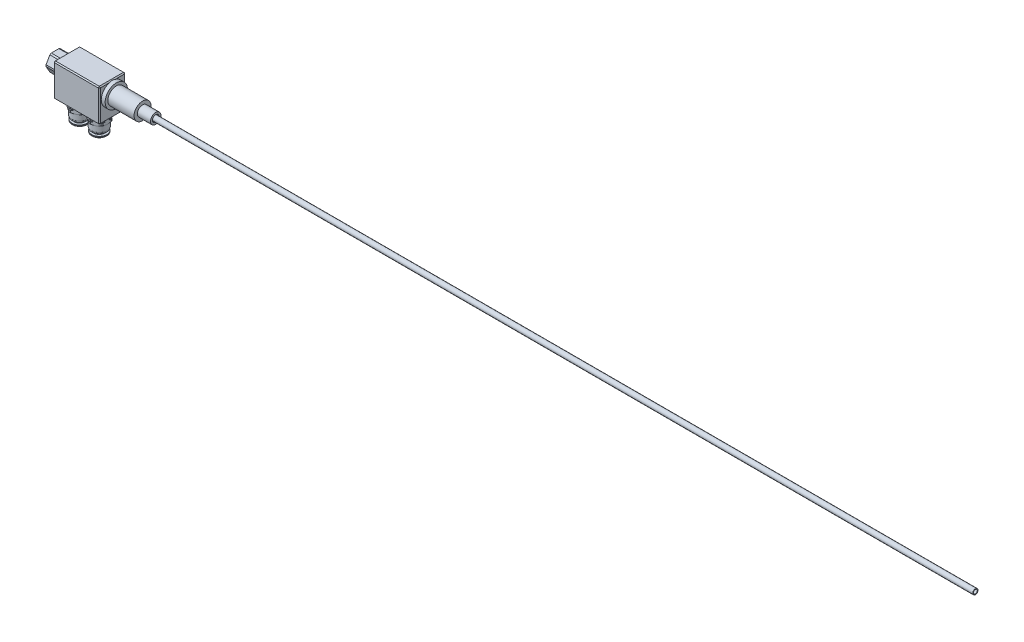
SolidWorks part; units mm, degrees
other "MLFS25-"
other "MLFS25"
ref_plane "Front Plane" through (0, 0, 0) normal (0, 0, 1) x (1, 0, 0)
ref_plane "Top Plane" through (0, 0, 0) normal (0, 1, 0) x (1, 0, 0)
ref_plane "Right Plane" through (0, 0, 0) normal (1, 0, 0) x (0, 0, -1)
sketch "Sketch1" plane through (0, 0, 0) normal (0, 0, 1) x (1, 0, 0)
  line L0 (-71.9924, 0) -> (105.9462, 0) construction
  line L1 (0, 3.9688) -> (0, 6.477)
  line L2 (0, 6.477) -> (-20, 6.477)
  line L3 (-20, 6.477) -> (-20, 8.5)
  line L4 (-20, 8.5) -> (-23, 8.5)
  line L5 (-23, 8.5) -> (-23, 2.5)
  line L6 (-23, 2.5) -> (10.0076, 2.5)
  line L7 (0, 3.9688) -> (10.0076, 3.9688)
  line L8 (10.0076, 3.9688) -> (10.0076, 2.5)
  dimension "D1" = 23
  dimension "D2" = 12.954
  dimension "D3" = 17
  dimension "D4" = 3
  dimension "D5" = 7.9375
  dimension "D6" = 10.0076
  dimension "D7" = 5
revolve "Revolve1" add sketch "Sketch1" angle 360 about L0
sketch "Sketch2" plane through (0, 0, 0) normal (0, 0, 1) x (1, 0, 0)
  line L0 (0, 0) -> (-72.5041, 0) construction
  line L1 (-23, 9) -> (-58, 9)
  line L2 (-23, 9) -> (-23, -16)
  line L3 (-23, -16) -> (-58, -16)
  line L4 (-58, 9) -> (-58, -16)
  line L5 (-23, 8.5) -> (-23, -8.5) construction
  dimension "D1" = 9
  dimension "D2" = 25
  dimension "D3" = 35
extrude "Boss-Extrude1" add sketch "Sketch2" along normal mid plane 20
sketch "Sketch3" plane through (0, 0, 0) normal (0, 0, 1) x (1, 0, 0)
  line L0 (-58, 6.985) -> (-66.636, 6.985)
  line L1 (-58, 9) -> (-58, -16) construction
  line L2 (-66.636, 6.985) -> (-66.636, 0)
  line L3 (-66.636, 0) -> (-58, 0)
  line L4 (-58, 0) -> (-58, 6.985)
  line L5 (-58, 0) -> (-71.1377, 0) construction
  dimension "D1" = 8.636
  dimension "D2" = 13.97
revolve "Revolve2" add sketch "Sketch3" angle 360 about L5
hole_wizard "1/8 NPT Tapped Hole1" positions "Sketch5" profile "Sketch4" size "1/8" standard "ANSI Inch"
sketch "Sketch5" plane through (0, -16, 0) normal (0, -1, 0) x (-1, 0, 0)
  line L0 (23, -10) -> (23, 10) construction
  point P0 (33, 0)
  point P2 (48, 0)
  dimension "D1" = 10
  dimension "D2" = 15
sketch "Sketch4" plane through (-33, -16, 0) normal (1, 0, 0) x (0, 0, -1)
  line L0 (0, 0) -> (0, 14.2175)
  line L1 (4.2164, 11.684) -> (0, 14.2175)
  line L2 (-4.2164, 11.684) -> (0, 14.2175) construction
  line L3 (4.2164, 11.684) -> (4.2164, 6.858)
  line L4 (4.2164, 6.858) -> (4.5374, 6.858)
  line L5 (4.5374, 6.858) -> (4.7427, 0)
  line L6 (-4.5374, 6.858) -> (-4.7427, 0) construction
  line L7 (4.7427, 0) -> (0, 0)
  line L8 (0, -6.35) -> (0, 107.95) construction
  line L11 (-4.2164, 6.858) -> (-4.5374, 6.858) construction
  dimension "Tap Drill Dia." = 8.4328
  dimension "Tap Drill Depth" = 11.684
  dimension "Thread Dia." = 9.4855
  dimension "Thread Angle" = 3.43
  dimension "Thread Depth" = 6.858
  dimension "Drill Angle" = 118
chamfer "Chamfer1" distance 0.762 angle 45 12 edges at (-40.5, 9, -10) (-58, -3.5, -10) (-40.5, -16, -10) (-23, -3.5, -10) (-40.5, -16, 10) (-58, -3.5, 10) (-40.5, 9, 10) (-23, -3.5, 10) (-58, -16, 0) (-58, 9, 0) (-23, 9, 0) (-23, -16, 0)
sketch "Sketch7" plane through (0, 0, 0) normal (0, 0, 1) x (1, 0, 0)
  line L0 (0, 0) -> (208.6285, 0) construction
  line L1 (-23, 1.9939) -> (635, 1.9939)
  line L3 (635, 1.9939) -> (635, 1.4732)
  line L4 (635, 1.4732) -> (-23, 1.4732)
  line L5 (-23, 1.4732) -> (-23, 1.9939)
  line L6 (-23, 8.238) -> (-23, -15.238) construction
  dimension "D1" = 3.9878
  dimension "D2" = 635
  dimension "D3" = 2.9464
revolve "Revolve4" add sketch "Sketch7" angle 360 about L0
sketch "Sketch8" plane through (-66.636, 0, 0) normal (-1, 0, 0) x (0, 0, 1)
  line L1 (1.8331, -3.175) -> (3.6662, 0)
  line L2 (3.6662, 0) -> (1.8331, 3.175)
  line L3 (1.8331, 3.175) -> (-1.8331, 3.175)
  line L4 (-1.8331, 3.175) -> (-3.6662, 0)
  line L5 (-3.6662, 0) -> (-1.8331, -3.175)
  line L6 (-1.8331, -3.175) -> (1.8331, -3.175)
  circle A0 centre (0, 0) radius 3.175 construction
  dimension "D1" = 6.35
extrude "Cut-Extrude1" cut sketch "Sketch8" against normal blind 6.604
sketch "Sketch9" plane through (-66.636, 0, 0) normal (-1, 0, 0) x (0, 0, 1)
  line L1 (-3.6662, 6.35) -> (-7.3323, 0)
  line L2 (-7.3323, 0) -> (-3.6662, -6.35)
  line L3 (-3.6662, -6.35) -> (3.6662, -6.35)
  line L4 (3.6662, -6.35) -> (7.3323, 0)
  line L5 (7.3323, 0) -> (3.6662, 6.35)
  line L6 (3.6662, 6.35) -> (-3.6662, 6.35)
  circle A0 centre (0, 0) radius 6.35 construction
  dimension "D1" = 12.7
extrude "Cut-Extrude2" cut sketch "Sketch9" against normal up to surface (8.636 mm away) flip side to cut
inserted part "MLFS25"
move or copy body "Body-Move/Copy2" placed by mates yes
other "Distance1" parameters "D1"=0.762
inserted part "MLFS25-"
move or copy body "Body-Move/Copy4" placed by mates yes
other "Distance2" parameters "D1"=0.762
sketch "Sketch10" plane through (0, 0, -10) normal (0, 0, -1) x (-1, 0, 0)
  line L0 (33.838, -11.765) -> (33.838, 0.4467) construction
  line L1 (49.078, -11.765) -> (49.078, -4.1277) construction
  text T0 "OUT"
  text T1 "IN"
  point P3 (49.078, -11.765)
  point P4 (33.838, -11.765)
extrude "Cut-Extrude3" cut sketch "Sketch10" against normal blind 0.127
